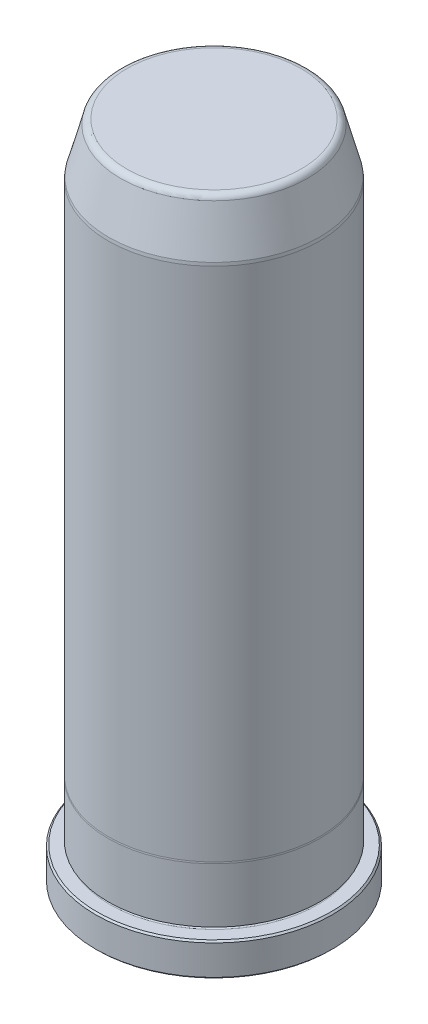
SolidWorks part; units mm, degrees
ref_plane "Front Plane" through (0, 0, 0) normal (0, 0, 1) x (1, 0, 0)
ref_plane "Top Plane" through (0, 0, 0) normal (0, 1, 0) x (1, 0, 0)
ref_plane "Right Plane" through (0, 0, 0) normal (1, 0, 0) x (0, 0, -1)
sketch "Sketch1" plane through (0, 0, 0) normal (1, 0, 0) x (0, 0, -1)
  line L0 (0, 0) -> (28.448, 0)
  line L1 (28.448, 0) -> (28.448, 7.9248)
  line L2 (28.448, 7.9248) -> (25.0063, 7.9248)
  line L3 (24.6253, 4.7498) -> (24.6253, 5.5118) construction
  line L4 (25.0063, 8.6868) -> (25.4127, 8.6868)
  line L5 (25.4127, 8.6868) -> (25.4127, 21.8618)
  line L6 (25.4127, 21.8618) -> (25.3873, 22.225)
  line L7 (25.3873, 22.225) -> (25.3873, 146.05)
  line L9 (22.1219, 158.75) -> (0, 158.75)
  line L10 (0, 158.75) -> (0, 0)
  line L11 (0, 0) -> (0, -13.6287) construction
  line L12 (25.3873, 146.05) -> (25.3206, 146.812)
  line L13 (25.3206, 146.812) -> (22.1219, 158.75)
  arc A0 (25.0063, 8.6868) -> (25.0063, 7.9248) centre (25.0063, 8.3058) ccw
  dimension "D14" = 0.762
  dimension "T" = 7.9248
  dimension "D2" = 0.762
  dimension "M" = 56.896
  dimension "B" = 50.8254
  dimension "L" = 158.75
  dimension "D7" = 0.7874
  dimension "A" = 22.225
  dimension "D8" = 4
  dimension "D10" = 5
  dimension "D11" = 15
  dimension "D12" = 0.762
  dimension "K" = 12.7
  dimension "D" = 50.7746
revolve "Revolve1" add sketch "Sketch1" angle 360 about L11
fillet "Fillet6" radius 1.5875 1 edges at (0, 158.75, 22.1219)
chamfer "Chamfer1" distance 0.381 angle 45 2 edges at (0, 0, 28.448) (0, 7.9248, 28.448)
